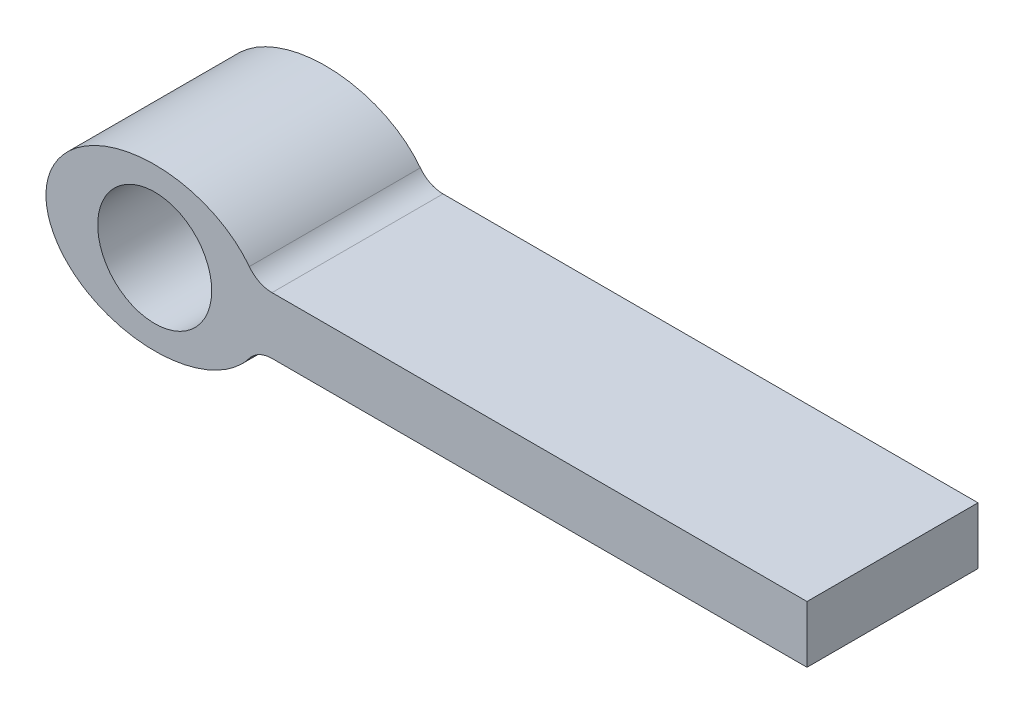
SolidWorks part; units mm, degrees
ref_plane "Płaszczyzna przednia" through (0, 0, 0) normal (0, 0, 1) x (1, 0, 0)
ref_plane "Płaszczyzna górna" through (0, 0, 0) normal (0, 1, 0) x (1, 0, 0)
ref_plane "Płaszczyzna prawa" through (0, 0, 0) normal (1, 0, 0) x (0, 0, -1)
sketch "Szkic1" plane through (0, 0, 0) normal (0, 0, 1) x (1, 0, 0)
  line L0 (8.2331, 2) -> (45.7767, 2)
  line L1 (45.7767, 2) -> (45.7767, -2)
  line L2 (45.7767, -2) -> (8.2331, -2)
  line L3 (0, 0) -> (45.7767, 0) construction
  arc A1 (8.2331, -2) -> (6.6416, -2.7887) centre (8.2331, -4) ccw
  arc A2 (8.2331, 2) -> (6.6416, 2.7887) centre (8.2331, 4) cw
  circle A3 centre (0, 0) radius 4
  ellipse E0 centre (0, 0) end of major axis (-7.6295, 0) minor radius 5.6667 (6.6416, 2.7887) -> (6.6416, -2.7887) ccw
  point P12 (-4, 0)
  dimension "Promień" = 2
  dimension "Fi" = 8
  dimension "Długość" = 45.7767
  dimension "Szerokość" = 4
  dimension "G" = 11.3333
  dimension "h" = 3.6295
extrude "Dodanie-wyciągnięcie1" add sketch "Szkic1" along normal mid plane 12
